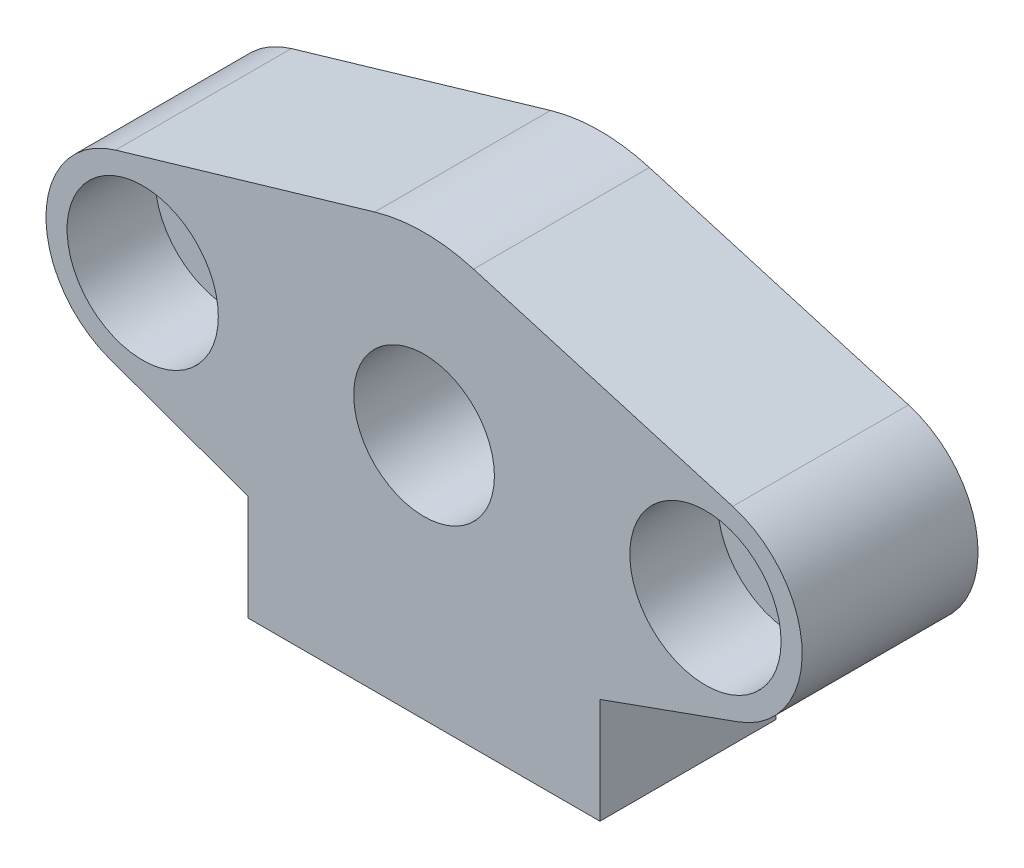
SolidWorks part; units mm, degrees
ref_plane "前视基准面" through (0, 0, 0) normal (0, 0, 1) x (1, 0, 0)
ref_plane "上视基准面" through (0, 0, 0) normal (0, 1, 0) x (1, 0, 0)
ref_plane "右视基准面" through (0, 0, 0) normal (1, 0, 0) x (0, 0, -1)
sketch "草图1" plane through (0, 0, 0) normal (0, 0, 1) x (1, 0, 0)
  line L0 (0, 0) -> (39.3469, 0) construction
  line L1 (0, 0) -> (0, 25.3878) construction
  line L2 (-10, -14) -> (-10, -8)
  line L3 (-10, -14) -> (10, -14)
  line L4 (-17.5469, 5.278) -> (-2.8125, 9.5963)
  line L5 (-10, -8) -> (-17.8597, -5.176)
  line L6 (0, -55) -> (0, 55) construction
  line L7 (17.5469, 5.278) -> (2.8125, 9.5963)
  line L8 (10, -8) -> (17.8597, -5.176)
  line L9 (10, -14) -> (10, -8)
  circle A0 centre (0, 0) radius 4
  circle A2 centre (-16, 0) radius 2.5
  arc A3 (2.8125, 9.5963) -> (-2.8125, 9.5963) centre (0, 0) ccw
  arc A4 (-17.5469, 5.278) -> (-17.8597, -5.176) centre (-16, 0) ccw
  circle A5 centre (16, 0) radius 2.5
  arc A6 (17.5469, 5.278) -> (17.8597, -5.176) centre (16, 0) cw
  point P27 (0, -14)
  dimension "D1" = 20
  dimension "D4" = 14
  dimension "D5" = 10
  dimension "D3" = 11
  dimension "D6" = 8
  dimension "D7" = 5
  dimension "D2" = 16
  dimension "D8" = 6
extrude "凸台-拉伸1" add sketch "草图1" along normal blind 10
sketch "草图2" plane through (0, 0, 10) normal (0, 0, 1) x (1, 0, 0)
  circle A0 centre (-16, 0) radius 4.3
  circle A1 centre (16, 0) radius 4.3
  dimension "D1" = 8.6
  dimension "D2" = 8.6
extrude "切除-拉伸1" cut sketch "草图2" against normal blind 5
